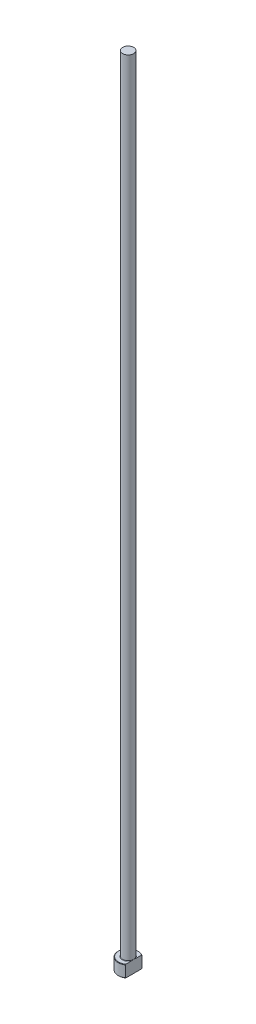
SolidWorks part; units mm, degrees
ref_plane "Front Plane" through (0, 0, 0) normal (0, 0, 1) x (1, 0, 0)
ref_plane "Top Plane" through (0, 0, 0) normal (0, 1, 0) x (1, 0, 0)
ref_plane "Right Plane" through (0, 0, 0) normal (1, 0, 0) x (0, 0, -1)
sketch "Sketch1" plane through (0, 0, 0) normal (0, 0, 1) x (1, 0, 0)
  line L0 (0, 259.9588) -> (0, -15.1925) construction
  line L1 (0, 0) -> (-5, 0)
  line L2 (-5, 0) -> (-5, 6)
  line L3 (-5, 6) -> (-2.75, 6)
  line L4 (-2.75, 6) -> (-2.75, 400)
  line L5 (-2.75, 400) -> (0, 400)
  line L6 (0, 400) -> (0, 0)
  dimension "L" = 400
  dimension "H" = 10
  dimension "T" = 6
  dimension "D" = 5.5
revolve "Revolve1" add sketch "Sketch1" angle 360 about L0
chamfer "Chamfer1" distance 0.2 angle 45 2 edges at (0, 6, 5) (0, 0, 5)
fillet "Fillet1" radius 0.2 1 edges at (0, 6, 2.75)
sketch "Sketch2" plane through (0, 0, 0) normal (0, 1, 0) x (1, 0, 0)
  line L0 (2.75, -4.1758) -> (2.75, 4.1758)
  circle A0 centre (0, 0) radius 5 construction
  arc A1 (2.75, -4.1758) -> (2.75, 4.1758) centre (0, 0) ccw
  circle A2 centre (0, 0) radius 2.75 construction
extrude "KEYED HEAD" cut sketch "Sketch2" along normal through all
